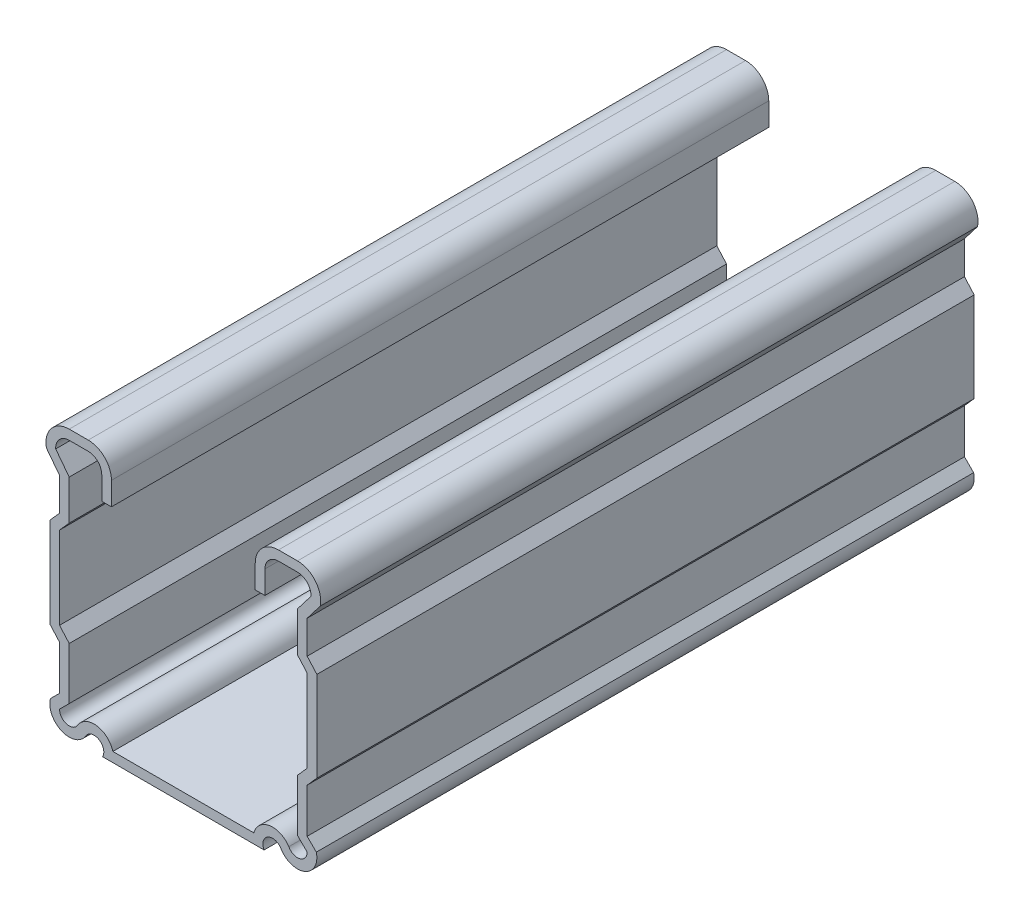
SolidWorks part; units mm, degrees
ref_plane "Plane1" through (0, 0, 0) normal (0, 0, 1) x (1, 0, 0)
ref_plane "Plane2" through (0, 0, 0) normal (0, 1, 0) x (1, 0, 0)
ref_plane "Plane3" through (0, 0, 0) normal (1, 0, 0) x (0, 0, -1)
other "Configuration Table"
sketch "Sketch1" plane through (0, 0, 0) normal (0, 0, 1) x (1, 0, 0)
  line L0 (17.6403, 16.3393) -> (19.7299, 19.0635)
  line L1 (17.6403, -13.9795) -> (19.1389, -15.4781)
  line L2 (-17.6403, -13.9795) -> (-19.1389, -15.4781)
  line L4 (-17.6403, -13.9795) -> (-17.6403, -5.9368)
  line L5 (17.6403, 21.2598) -> (14.7033, 21.2598)
  line L6 (12.6111, 19.1676) -> (12.6111, 15.6147)
  line L7 (-17.6403, -5.9368) -> (-19.1389, -4.2539)
  line L8 (-12.6111, 19.1676) -> (-12.6111, 15.6147)
  line L9 (0, 10.16) -> (0, -7.62) construction
  line L10 (-19.1389, -4.2539) -> (-19.1389, 8.4957)
  line L11 (-17.6403, 10.1786) -> (-19.1389, 8.4957)
  line L12 (-17.6403, 10.1786) -> (-17.6403, 16.3393)
  line L13 (-17.6403, 16.3393) -> (-19.7299, 19.0635)
  line L14 (-17.6403, 21.2598) -> (-14.7033, 21.2598)
  line L16 (17.6403, -13.9795) -> (17.6403, -5.9368)
  line L17 (17.6403, 10.1786) -> (17.6403, 16.3393)
  line L18 (-11.1125, 19.1676) -> (-11.1125, 15.6147)
  line L19 (-17.6403, 22.7584) -> (-14.7033, 22.7584)
  line L20 (-19.1389, 15.8307) -> (-21.1624, 18.4689)
  line L21 (-19.1389, 10.7491) -> (-19.1389, 15.8307)
  line L22 (-19.1389, 10.7491) -> (-20.6375, 9.0662)
  line L23 (-20.6375, -4.8244) -> (-20.6375, 9.0662)
  line L24 (-19.1389, -6.5073) -> (-20.6375, -4.8244)
  line L25 (19.1389, -4.2539) -> (19.1389, 8.4957)
  line L26 (-19.1389, -13.3588) -> (-19.1389, -6.5073)
  line L27 (-19.1389, -13.3588) -> (-20.5535, -14.7733)
  line L28 (11.1125, 19.1676) -> (11.1125, 15.6147)
  line L29 (17.6403, 22.7584) -> (14.7033, 22.7584)
  line L30 (19.1389, 15.8307) -> (21.1624, 18.4689)
  line L31 (19.1389, 10.7491) -> (19.1389, 15.8307)
  line L32 (19.1389, 10.7491) -> (20.6375, 9.0662)
  line L33 (20.6375, -4.8244) -> (20.6375, 9.0662)
  line L34 (19.1389, -6.5073) -> (20.6375, -4.8244)
  line L35 (19.1389, -13.3588) -> (19.1389, -6.5073)
  line L36 (19.1389, -13.3588) -> (20.5535, -14.7733)
  line L37 (17.6403, -5.9368) -> (19.1389, -4.2539)
  line L38 (-12.4806, -18.5166) -> (12.4806, -18.5166)
  line L39 (17.6403, 10.1786) -> (19.1389, 8.4957)
  line L41 (-10.899, -17.018) -> (10.899, -17.018)
  line L42 (-12.6111, 15.6147) -> (-11.1125, 15.6147)
  line L43 (11.1125, 15.6147) -> (12.6111, 15.6147)
  arc A0 (19.1389, -15.4781) -> (16.3052, -16.1588) centre (17.6403, -15.4781) cw
  arc A1 (16.3052, -16.1588) -> (10.899, -17.018) centre (13.7938, -17.7947) ccw
  arc A2 (-16.4143, -16.3399) -> (-10.899, -17.018) centre (-13.7938, -17.7947) cw
  arc A3 (-19.1389, -15.4781) -> (-16.4143, -16.3399) centre (-17.6403, -15.4781) ccw
  arc A4 (-17.6403, 21.2598) -> (-19.7299, 19.0635) centre (-17.6403, 19.1676) ccw
  arc A5 (-12.6111, 19.1676) -> (-14.7033, 21.2598) centre (-14.7033, 19.1676) ccw
  arc A6 (17.6403, 21.2598) -> (19.7299, 19.0635) centre (17.6403, 19.1676) cw
  arc A7 (12.6111, 19.1676) -> (14.7033, 21.2598) centre (14.7033, 19.1676) cw
  arc A8 (-11.1125, 19.1676) -> (-14.7033, 22.7584) centre (-14.7033, 19.1676) ccw
  arc A9 (-17.6403, 22.7584) -> (-21.1624, 18.4689) centre (-17.6403, 19.1676) ccw
  arc A10 (-20.5535, -14.7733) -> (-15.0198, -16.9329) centre (-17.6403, -15.4781) ccw
  arc A11 (11.1125, 19.1676) -> (14.7033, 22.7584) centre (14.7033, 19.1676) cw
  arc A12 (17.6403, 22.7584) -> (21.1624, 18.4689) centre (17.6403, 19.1676) cw
  arc A13 (20.5535, -14.7733) -> (15.0198, -16.9329) centre (17.6403, -15.4781) cw
  arc A14 (15.0198, -16.9329) -> (12.4806, -18.5166) centre (13.7938, -17.7947) ccw
  arc A15 (-15.0198, -16.9329) -> (-12.4806, -18.5166) centre (-13.7938, -17.7947) cw
  dimension "D9" = 7.1437
  dimension "base" = 18.5166
  dimension "D5" = 9.525
  dimension "ToeHt" = 22.7584
  dimension "D6" = 22.225
  dimension "D8" = 15.4781
  dimension "D12" = 41.275
  dimension "D14" = 13.6922
  dimension "D15" = 13.8906
extrude "Base-Extrude" add sketch "Sketch1" along normal blind 101.6
other "Hole1"
sketch "Sketch3" plane through (0, -18.5166, 0) normal (0, -1, 0) x (1, 0, 0)
  circle A0 centre (0, 23.8125) radius 7.1438
  dimension "D1" = 14.2875
  dimension "D2" = 23.8125
pattern_linear "LPattern2" count 2 spacing 47.625 along (0, 0, 1) of "Hole1"
equation "\"D1@LPattern2\" = \"D1@Base-Extrude\" / \"D3@LPattern2\""
